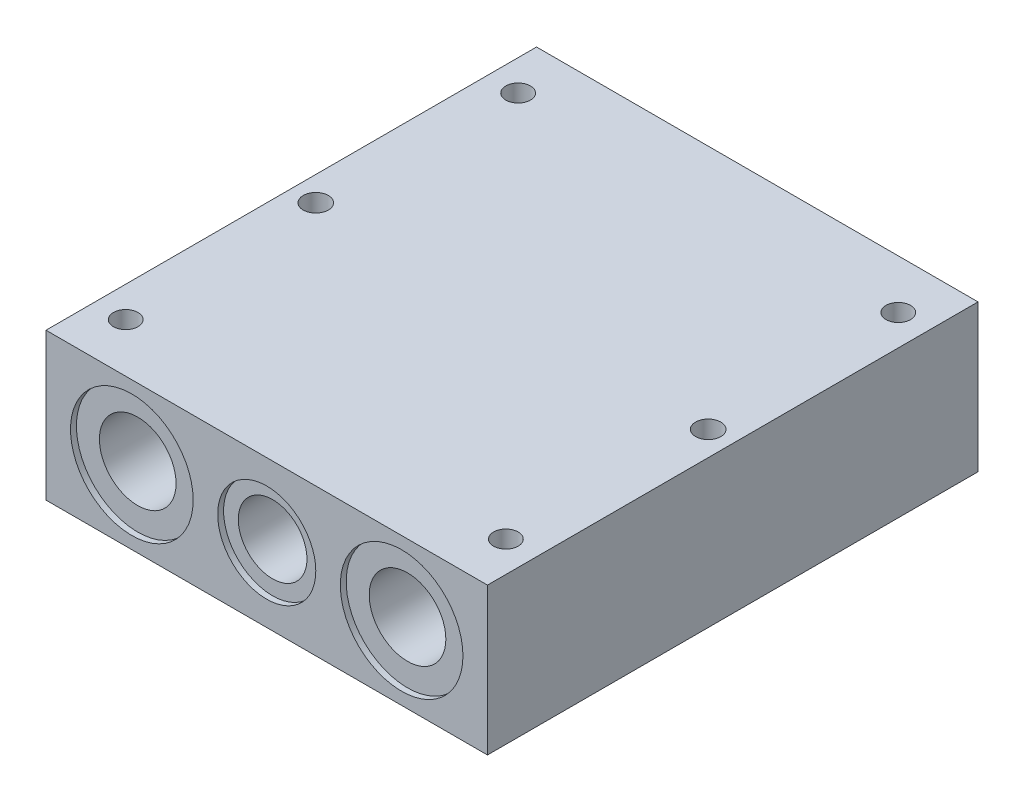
SolidWorks part; units mm, degrees
ref_plane "Front/Back" through (0, 0, 0) normal (0, 0, 1) x (1, 0, 0)
ref_plane "Top/Bottom" through (0, 0, 0) normal (0, 1, 0) x (1, 0, 0)
ref_plane "Right/Left" through (0, 0, 0) normal (1, 0, 0) x (0, 0, -1)
sketch "Sketch1" plane through (0, 0, 0) normal (0, 1, 0) x (1, 0, 0)
  line L0 (0, 0) -> (57.15, 0) construction
  line L1 (-57.15, 63.5) -> (57.15, 63.5)
  line L2 (-57.15, 63.5) -> (-57.15, -63.5)
  line L3 (-57.15, -63.5) -> (57.15, -63.5)
  line L4 (57.15, 63.5) -> (57.15, -63.5)
  line L5 (0, 0) -> (0, 63.5) construction
  dimension "D1" = 114.3
  dimension "D2" = 127
extrude "Extrude1" add sketch "Sketch1" along normal mid plane 38.1
sketch "Sketch2" plane through (0, 0, 63.5) normal (0, 0, 1) x (1, 0, 0)
  line L0 (0, 0) -> (0, 25.6254) construction
  line L1 (0, 0) -> (62.4063, 0) construction
  circle A0 centre (34.925, 0) radius 9.9219
  circle A1 centre (-34.925, 0) radius 9.9219
  dimension "D1" = 19.8438
  dimension "D2" = 69.85
extrude "Cut-Extrude1" cut sketch "Sketch2" against normal through all
sketch "Sketch3" plane through (0, 0, 63.5) normal (0, 0, 1) x (1, 0, 0)
  circle A0 centre (34.925, 0) radius 15.875
  circle A1 centre (-34.925, 0) radius 15.875
  dimension "D1" = 31.75
extrude "Cut-Extrude2" cut sketch "Sketch3" against normal blind 1.524
sketch "Sketch4" plane through (0, 0, -63.5) normal (0, 0, -1) x (-1, 0, 0)
  circle A0 centre (34.925, 0) radius 15.875
  circle A1 centre (-34.925, 0) radius 15.875
  dimension "D1" = 31.75
extrude "Cut-Extrude3" cut sketch "Sketch4" against normal blind 1.524
sketch "Sketch5" plane through (0, 0, 63.5) normal (0, 0, 1) x (1, 0, 0)
  circle A0 centre (0, 0) radius 8.89
  dimension "D1" = 17.78
extrude "Cut-Extrude4" cut sketch "Sketch5" against normal through all
sketch "Sketch6" plane through (0, 0, 63.5) normal (0, 0, 1) x (1, 0, 0)
  circle A0 centre (0, 0) radius 12.7
  dimension "D1" = 25.4
extrude "Cut-Extrude5" cut sketch "Sketch6" against normal blind 1.524
sketch "Sketch7" plane through (0, 0, -63.5) normal (0, 0, -1) x (-1, 0, 0)
  circle A0 centre (0, 0) radius 12.7
  dimension "D1" = 25.4
extrude "Cut-Extrude6" cut sketch "Sketch7" against normal blind 1.524
hole_wizard "5/16-18 (Mounting Holes)" positions "Sketch9" profile "Sketch8" tap size "5/16-18" standard "Ansi Inch"
sketch "Sketch9" plane through (0, 19.05, 0) normal (0, 1, 0) x (-1, 0, 0)
  line L0 (57.15, 63.5) -> (-57.15, 63.5) construction
  line L1 (0, 0) -> (0, 38.2418) construction
  line L2 (0, -61.976) -> (0, 61.976) construction
  line L3 (0, 0) -> (26.7344, 0) construction
  point P0 (50.8, 0)
  point P9 (-50.8, 0)
  dimension "D1" = 63.5
  dimension "D2" = 101.6
sketch "Sketch8" plane through (-50.8, 19.05, 0) normal (1, 0, 0) x (0, 0, 1)
  line L0 (0, 0) -> (0, 38.1)
  line L1 (0, 38.1) -> (3.2639, 38.1)
  line L2 (3.2639, 38.1) -> (3.2639, 0)
  line L5 (3.2639, 0) -> (0, 0)
  line L11 (0, -6.35) -> (0, 107.95) construction
  dimension "Thru Tap Drill Dia." = 6.5278
  dimension "Thru Tap Drill Depth" = 38.1
hole_wizard "(1/4 Dowel Holes - Slip Fit)" positions "Sketch11" profile "Sketch10" legacy
sketch "Sketch11" plane through (0, 19.05, 0) normal (0, 1, 0) x (-1, 0, 0)
  line L0 (0, 0) -> (75.7862, 0) construction
  line L1 (0, 0) -> (0, 67.5334) construction
  line L2 (0, -61.976) -> (0, 61.976) construction
  line L3 (57.15, 63.5) -> (-57.15, 63.5) construction
  point P0 (49.2125, 50.8)
  point P1 (49.2125, -50.8)
  point P2 (-49.2125, -50.8)
  point P3 (-49.2125, 50.8)
  dimension "D1" = 98.425
  dimension "D2" = 101.6
  dimension "D3" = 12.7
sketch "Sketch10" plane through (-49.2125, 19.05, 50.8) normal (1, 0, 0) x (0, 0, 1)
  line L0 (0, 0) -> (0, 6.35)
  line L1 (0, 6.35) -> (3.1877, 6.35)
  line L2 (3.1877, 6.35) -> (3.1877, 0)
  line L3 (3.1877, 0) -> (0, 0)
  line L4 (0, 110) -> (0, -10) construction
  dimension "Diameter" = 6.3754
  dimension "Depth" = 6.35
